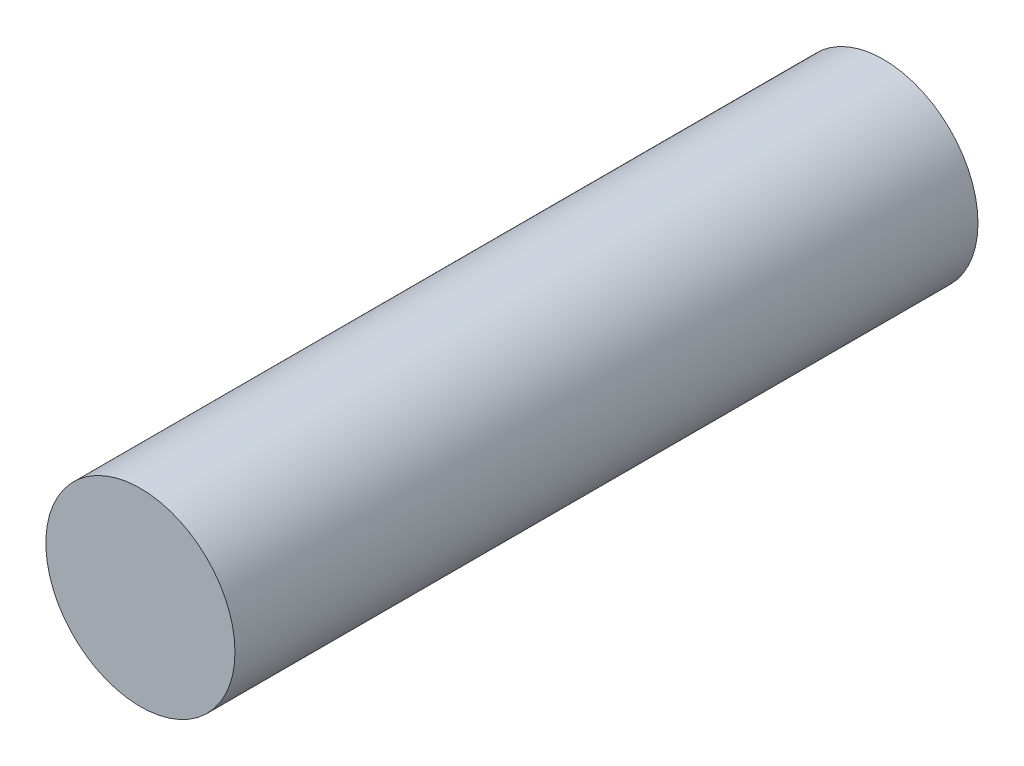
SolidWorks part; units mm, degrees
ref_plane "Alzado" through (0, 0, 0) normal (0, 0, 1) x (1, 0, 0)
ref_plane "Planta" through (0, 0, 0) normal (0, 1, 0) x (1, 0, 0)
ref_plane "Vista lateral" through (0, 0, 0) normal (1, 0, 0) x (0, 0, -1)
sketch "Croquis1" plane through (0, 0, 0) normal (0, 0, 1) x (1, 0, 0)
  circle A0 centre (0, 0) radius 1.4
  dimension "D1" = 2.8
extrude "Saliente-Extruir1" add sketch "Croquis1" along normal blind 11
